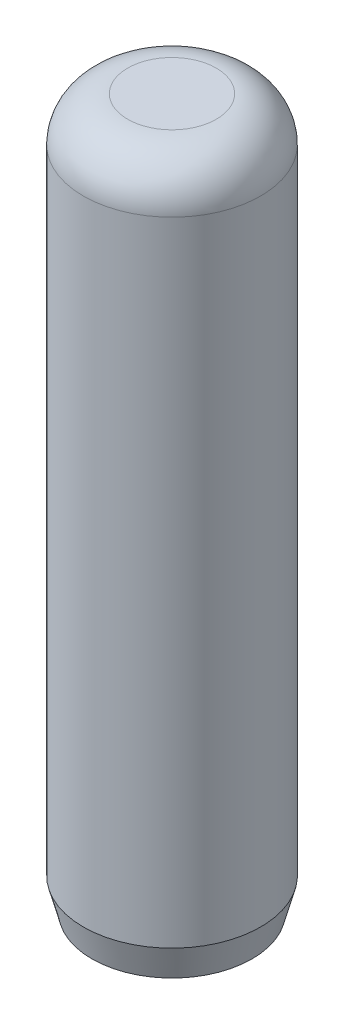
SolidWorks part; units mm, degrees
ref_plane "Front x-y" through (0, 0, 0) normal (0, 0, 1) x (1, 0, 0)
ref_plane "Top x-z" through (0, 0, 0) normal (0, 1, 0) x (1, 0, 0)
ref_plane "Side y-z" through (0, 0, 0) normal (1, 0, 0) x (0, 0, -1)
sketch "Sketch1" plane through (0, 0, 0) normal (0, 0, 1) x (1, 0, 0)
  line L0 (0.0038, 0) -> (0.0038, 12.7) construction
  line L1 (0.0038, 0) -> (0.0038, 12.7)
  line L2 (0.0038, 12.7) -> (0.7976, 12.7)
  line L3 (1.5913, 11.9062) -> (1.5913, 0.5721)
  line L4 (1.5913, 0.5721) -> (1.438, 0)
  line L5 (1.438, 0) -> (0.0038, 0)
  arc A0 (1.5913, 11.9062) -> (0.7976, 12.7) centre (0.7976, 11.9062) ccw
  dimension "D4" = 1.5875
  dimension "D1" = 0.7937
  dimension "D2" = 12.7
  dimension "D3" = 0.1533
  dimension "D5" = 15
  dimension "D6" = 1.5913
  dimension "D7" = 0.7937
  dimension "D8" = 1.4342
  dimension "D9" = 12.7
revolve "Base-Revolve" add sketch "Sketch1" angle 360 about L0
